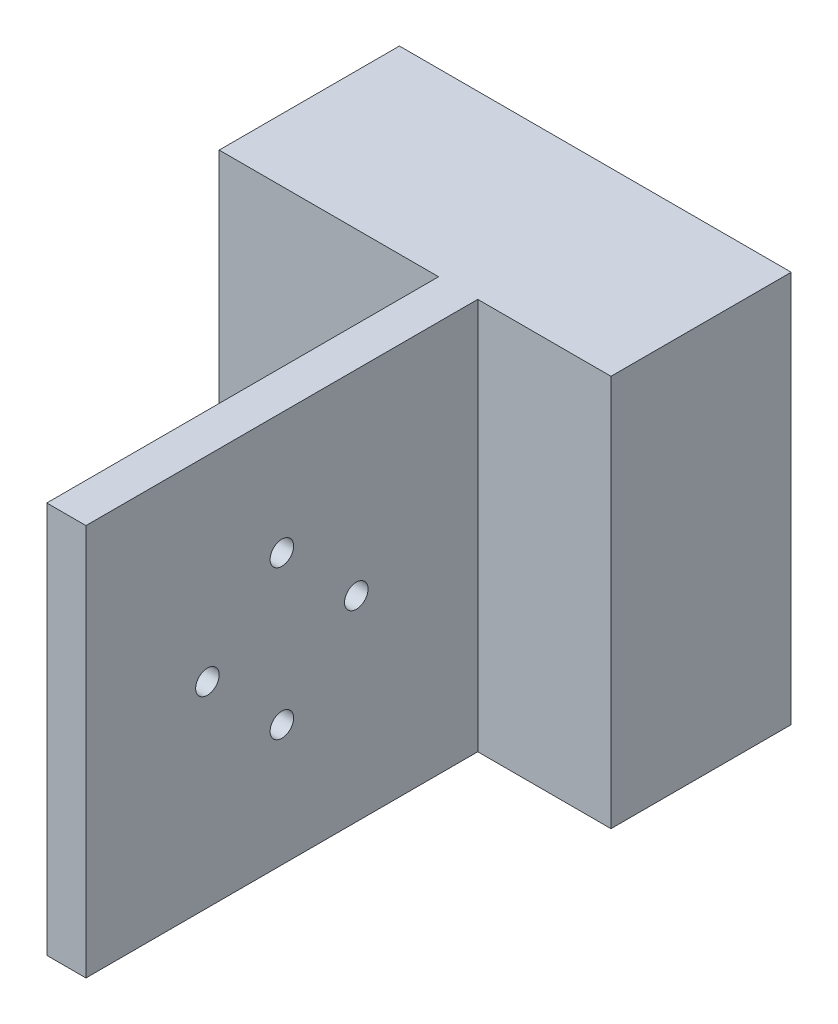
SolidWorks part; units mm, degrees
ref_plane "Front Plane" through (0, 0, 0) normal (0, 0, 1) x (1, 0, 0)
ref_plane "Top Plane" through (0, 0, 0) normal (0, 1, 0) x (1, 0, 0)
ref_plane "Right Plane" through (0, 0, 0) normal (1, 0, 0) x (0, 0, -1)
sketch "Sketch1" plane through (0, 0, 0) normal (1, 0, 0) x (0, -1, 0)
  line L1 (-25, 25) -> (25, 25)
  line L2 (-25, 25) -> (-25, -25)
  line L3 (-25, -25) -> (25, -25)
  line L4 (25, 25) -> (25, -25)
  line L5 (-25, 25) -> (25, -25) construction
  line L6 (-25, -25) -> (25, 25) construction
  circle A1 centre (0, 0) radius 9.5 construction
  circle A2 centre (0, 9.5) radius 1.5
  circle A3 centre (9.5, 0) radius 1.5
  circle A4 centre (0, -9.5) radius 1.5
  circle A5 centre (-9.5, 0) radius 1.5
  point P0 (0, 0)
  point P19 (0, 0)
  dimension "D1" = 19
  dimension "D2" = 3
  dimension "D5" = 25
  dimension "D3" = 25
  dimension "D4" = 4
extrude "Boss-Extrude1" add sketch "Sketch1" along normal blind 5
sketch "Sketch2" plane through (0, 0, -25) normal (0, 0, -1) x (-1, 0, 0)
  line L0 (-22, 25) -> (28, 25)
  line L1 (28, 25) -> (28, -25)
  line L2 (28, -25) -> (-22, -25)
  line L3 (-22, -25) -> (-22, 25)
  line L4 (-5, -25) -> (-5, 25) construction
  dimension "D1" = 50
  dimension "D2" = 17
extrude "Boss-Extrude2" add sketch "Sketch2" along normal blind 5
sketch "Sketch3" plane through (0, 0, -30) normal (0, 0, -1) x (-1, 0, 0)
  line L0 (-22, 25) -> (-22, -25)
  line L1 (-22, -25) -> (28, -25)
  line L2 (28, -25) -> (28, 25)
  line L3 (28, 25) -> (-22, 25)
  line L4 (-22, 25) -> (28, -25) construction
  line L5 (-22, -25) -> (28, 25) construction
  line L6 (-22, 25) -> (-22, -25) construction
  circle A0 centre (3, 0) radius 6
extrude "Boss-Extrude3" add sketch "Sketch3" along normal blind 18
equation "\"ShaftDiameter\"= 12mm"
equation "\"PendulumDiameter\"=12mm"
equation "\"PendulumLength\"= 140mm"
equation "\"D1@Sketch3\"=\"PendulumDiameter\""
